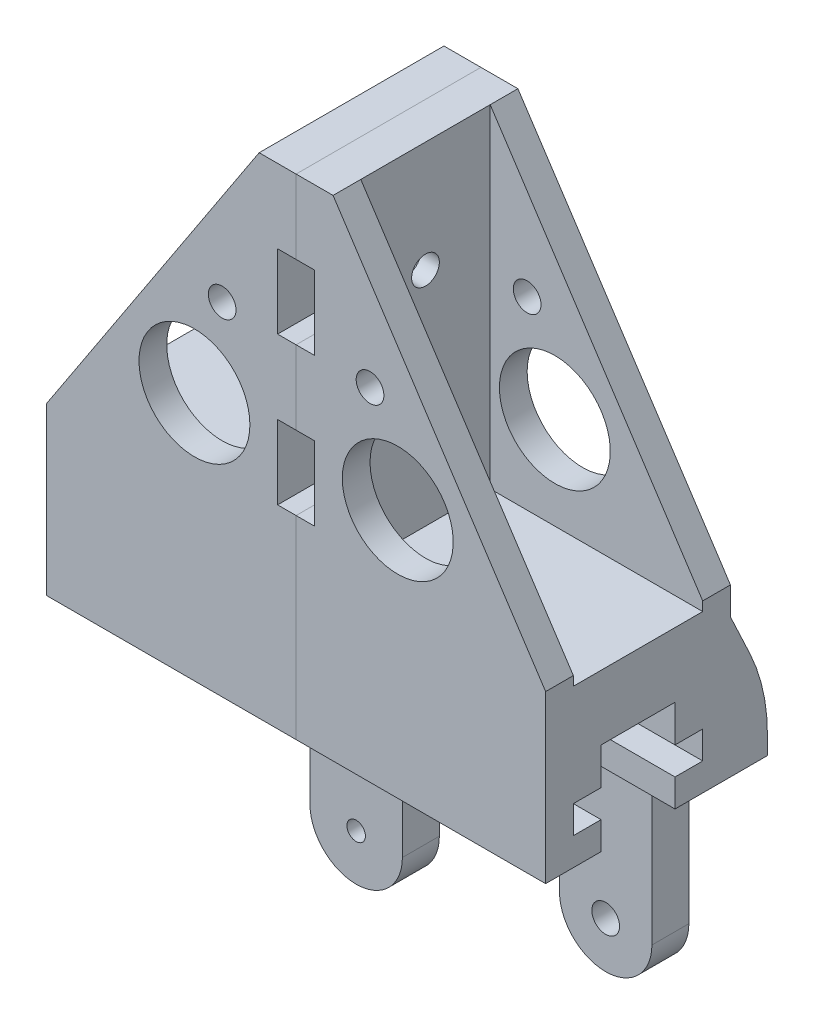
SolidWorks part; units mm, degrees
ref_plane "前视" through (0, 0, 0) normal (0, 0, 1) x (1, 0, 0)
ref_plane "上视" through (0, 0, 0) normal (0, 1, 0) x (1, 0, 0)
ref_plane "右视" through (0, 0, 0) normal (1, 0, 0) x (0, 0, -1)
sketch "草图1" plane through (0, 0, 0) normal (0, 0, 1) x (1, 0, 0)
  line L0 (0, 0) -> (2, 0)
  line L1 (2, 0) -> (25, -35)
  line L2 (25, -35) -> (25, -38)
  line L3 (25, -38) -> (0, -38)
  line L4 (0, -38) -> (0, 0)
  dimension "D1" = 38
  dimension "25" = 25
  dimension "D2" = 3
  dimension "D3" = 2
extrude "凸台-拉伸1" add sketch "草图1" along normal mid plane 20
shell "抽壳1" thickness 3
sketch "草图2" plane through (0, 0, 0) normal (0, 0, 1) x (1, 0, 0)
  line L0 (2, 0) -> (2, -36)
  line L1 (2, 0) -> (0, 0) construction
  line L2 (2, -36) -> (25, -36)
  line L3 (25, -38) -> (25, -35) construction
  line L4 (25, -36) -> (25, -35)
  line L5 (25, -35) -> (22, -30.4348)
  line L6 (22, -30.4348) -> (22, -35)
  line L7 (22, -35) -> (22, -30.4348) construction
  line L8 (3, -35) -> (22, -35) construction
  line L9 (22, -35) -> (3, -35)
  line L10 (3, -35) -> (3, -3)
  line L11 (3, -3) -> (3.9714, -3)
  line L12 (3.9714, -3) -> (2, 0)
  line L13 (0, -38) -> (25, -38) construction
  dimension "D1" = 2
extrude "切除-拉伸1" cut sketch "草图2" against normal mid plane 14
sketch "草图3" plane through (0, 0, 0) normal (0, 0, 1) x (1, 0, 0)
  line L1 (0, 0) -> (0, -38) construction
  line L2 (0, 0) -> (-2, 0)
  line L3 (0, 0) -> (0, -8)
  line L4 (0, -8) -> (-2, -8)
  line L5 (-2, 0) -> (-2, -8)
  line L6 (0, -16) -> (-2, -16)
  line L7 (0, -16) -> (0, -24)
  line L8 (0, -24) -> (-2, -24)
  line L9 (-2, -16) -> (-2, -24)
  line L10 (0, -38) -> (25, -38) construction
  line L11 (0, -32) -> (-2, -32)
  line L12 (0, -32) -> (0, -38)
  line L13 (0, -38) -> (-2, -38)
  line L14 (-2, -32) -> (-2, -38)
  dimension "D1" = 2
  dimension "D2" = 6
  dimension "D3" = 8
  dimension "D4" = 8
  dimension "D5" = 8
extrude "凸台-拉伸2" add sketch "草图3" along normal mid plane 20
sketch "草图4" plane through (0, 0, -10) normal (0, 0, -1) x (-1, 0, 0)
  line L0 (2, -38) -> (-25, -38) construction
  line L1 (0, -24) -> (0, -32) construction
  line L2 (0, -8) -> (0, -16) construction
  circle A0 centre (-9, -26) radius 6
  circle A1 centre (-6, -16) radius 1.5
  dimension "D1" = 12
  dimension "D2" = 3
  dimension "D3" = 12
  dimension "D4" = 9
  dimension "D5" = 22
  dimension "D6" = 6
extrude "切除-拉伸2" cut sketch "草图4" against normal blind 20
sketch "草图5" plane through (0, 0, 0) normal (-1, 0, 0) x (0, 0, 1)
  line L0 (0, 0) -> (0, -38) construction
  line L1 (10, -38) -> (-10, -38) construction
  line L2 (-10, -12) -> (10, -12) construction
  line L3 (-10, -8) -> (-10, -16) construction
  line L4 (10, -8) -> (10, -16) construction
  line L5 (-10, -28) -> (10, -28) construction
  line L6 (-10, -24) -> (-10, -32) construction
  line L7 (10, -24) -> (10, -32) construction
  circle A0 centre (0, -12) radius 1.5
  circle A1 centre (0, -28) radius 1.5
  dimension "D1" = 3
extrude "切除-拉伸3" cut sketch "草图5" against normal blind 20
sketch "草图6" plane through (25, 0, 0) normal (1, 0, 0) x (0, 0, -1)
  line L0 (-10, -38) -> (-10, -53)
  line L1 (-10, -38) -> (10, -38)
  line L2 (10, -38) -> (12.1176, -42.5294)
  line L3 (14, -51) -> (14, -53)
  line L4 (14, -53) -> (4, -53)
  line L7 (4, -50) -> (4, -53)
  line L8 (7, -50) -> (4, -50)
  line L9 (7, -47) -> (7, -50)
  line L10 (4, -47) -> (7, -47)
  line L11 (4, -43) -> (4, -47)
  line L12 (-4, -43) -> (4, -43)
  line L13 (-4, -43) -> (-4, -47)
  line L14 (-4, -47) -> (-7, -47)
  line L15 (-7, -47) -> (-7, -50)
  line L16 (-7, -50) -> (-4, -50)
  line L17 (-4, -50) -> (-4, -53)
  line L18 (-4, -53) -> (-10, -53)
  line L22 (0, -38) -> (0, -52.3559) construction
  arc A0 (14, -51) -> (12.1176, -42.5294) centre (-6, -51) ccw
  dimension "D8" = 20
  dimension "D1" = 15
  dimension "D2" = 3
  dimension "D3" = 3
  dimension "D4" = 4
  dimension "D5" = 6
  dimension "D6" = 3
  dimension "D7" = 6
  dimension "D9" = 10
  dimension "D10" = 2
extrude "凸台-拉伸3" add sketch "草图6" against normal up to surface (27 mm away)
sketch "草图7" plane through (0, 0, -14) normal (0, 0, -1) x (-1, 0, 0)
  line L0 (-11.5, -53) -> (-11.5, -73) construction
  line L1 (2, -53) -> (-25, -53) construction
  line L2 (-6.5, -53) -> (-6.5, -73)
  line L3 (-16.5, -53) -> (-16.5, -73)
  line L4 (-16.5, -53) -> (-6.5, -53)
  circle A0 centre (-11.5, -73) radius 1.5
  arc A1 (-16.5, -73) -> (-6.5, -73) centre (-11.5, -73) ccw
  point P4 (-11.5, -53)
  dimension "D2" = 25
  dimension "D3" = 3
  dimension "D1" = 10
extrude "凸台-拉伸4" add sketch "草图7" against normal blind 4
mirror "镜向1" about plane through (-2, -32, 10) normal (1, 0, 0)
sketch "草图8" plane through (0, 0, -14) normal (0, 0, -1) x (-1, 0, 0)
  line L0 (10.5, -73) -> (10.5, -78.3)
  line L2 (20.5, -78.3) -> (20.5, -73)
  arc A0 (10.5, -78.3) -> (20.5, -78.3) centre (15.5, -78.3) ccw
  arc A1 (10.5, -73) -> (20.5, -73) centre (15.5, -73) ccw
extrude "凸台-拉伸5" add sketch "草图8" against normal blind 4
sketch "草图9" plane through (0, 0, -14) normal (0, 0, -1) x (-1, 0, 0)
  circle A0 centre (15.5, -73) radius 1.5
extrude "凸台-拉伸6" add sketch "草图9" against normal blind 4
sketch "草图10" plane through (0, 0, -14) normal (0, 0, -1) x (-1, 0, 0)
  circle A0 centre (15.5, -78.3) radius 1
extrude "切除-拉伸4" cut sketch "草图10" against normal blind 4
